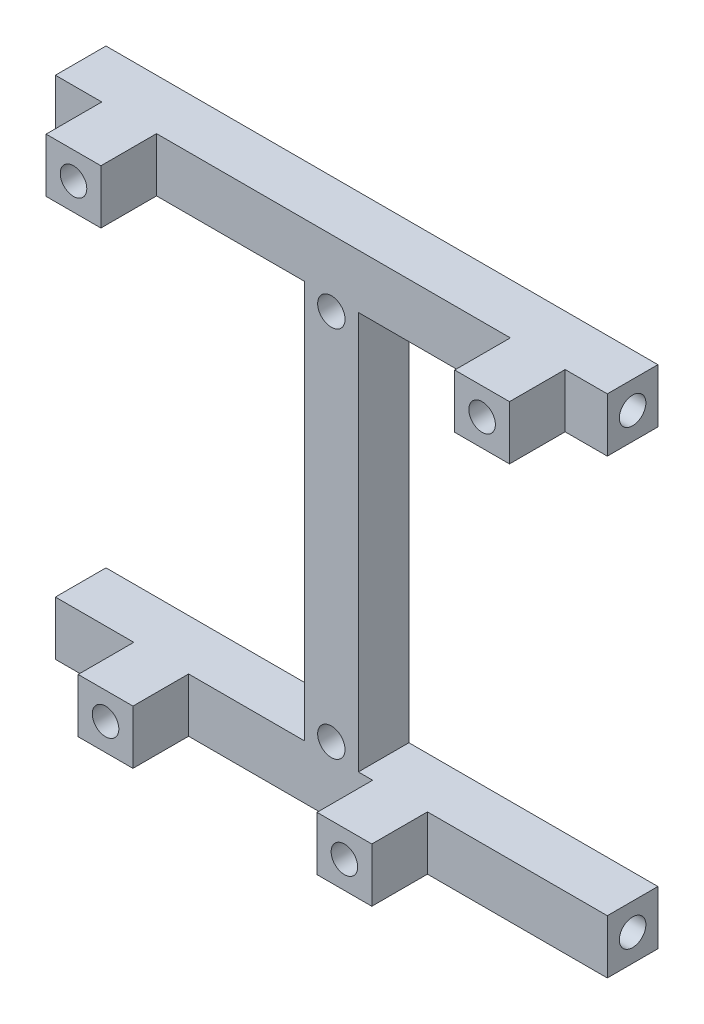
SolidWorks part; units mm, degrees
ref_plane "Front Plane" through (0, 0, 0) normal (0, 0, 1) x (1, 0, 0)
ref_plane "Top Plane" through (0, 0, 0) normal (0, 1, 0) x (1, 0, 0)
ref_plane "Right Plane" through (0, 0, 0) normal (1, 0, 0) x (0, 0, -1)
sketch "Sketch1" plane through (0, 0, 0) normal (0, 0, 1) x (1, 0, 0)
  line L1 (-39.73, -30) -> (39.73, -30)
  line L3 (-39.73, 30) -> (39.73, 30)
  line L5 (-39.73, -30) -> (39.73, 30) construction
  line L6 (-39.73, 30) -> (39.73, -30) construction
  line L8 (-39.73, 23.6) -> (-39.73, 30)
  line L9 (3.2, -23.6) -> (3.2, 23.6)
  line L10 (-3.2, -23.6) -> (-3.2, 23.6)
  line L11 (39.73, 23.6) -> (39.73, 30)
  line L12 (39.73, -23.6) -> (39.73, -30)
  line L13 (-39.73, -30) -> (-39.73, -23.6)
  line L14 (-39.73, -23.6) -> (-3.2, -23.6)
  line L15 (3.2, -23.6) -> (39.73, -23.6)
  line L16 (-39.73, 23.6) -> (-3.2, 23.6)
  line L17 (3.2, 23.6) -> (39.73, 23.6)
  point P0 (0, 0)
  dimension "D1" = 60
  dimension "D2" = 79.46
extrude "Boss-Extrude2" add sketch "Sketch1" along normal blind 6
sketch "Sketch2" plane through (0, 0, 6) normal (0, 0, 1) x (1, 0, 0)
  line L12 (21.23, 23.6) -> (27.73, 23.6)
  line L13 (27.73, 30) -> (21.23, 30)
  line L14 (27.73, 30) -> (27.73, 23.6)
  line L15 (-27.23, 30) -> (-20.73, 30)
  line L16 (21.23, 30) -> (21.23, 23.6)
  line L17 (-27.23, 23.6) -> (-27.23, 30)
  line L18 (-20.73, 23.6) -> (-20.73, 30)
  line L19 (-20.73, 23.6) -> (-27.23, 23.6)
  line L20 (-23.43, -30) -> (-16.93, -30)
  line L21 (-23.43, -30) -> (-23.43, -23.6)
  line L22 (-16.93, -30) -> (-16.93, -23.6)
  line L23 (-16.93, -23.6) -> (-23.43, -23.6)
  line L24 (4.9, -23.6) -> (11.4, -23.6)
  line L25 (11.4, -30) -> (11.4, -23.6)
  line L26 (4.9, -30) -> (4.9, -23.6)
  line L27 (11.4, -30) -> (4.9, -30)
extrude "Boss-Extrude3" add sketch "Sketch2" along normal blind 6.6
sketch "Sketch3" plane through (0, 0, 12.6) normal (0, 0, 1) x (1, 0, 0)
  line L0 (-23.43, -23.6) -> (-16.93, -30)
  line L1 (-16.93, -30) -> (-16.93, -23.6)
  line L2 (-16.93, -23.6) -> (-23.43, -30)
  line L3 (4.9, -23.6) -> (11.4, -30)
  line L4 (11.4, -30) -> (11.4, -23.6)
  line L5 (11.4, -23.6) -> (4.9, -30)
  line L6 (-27.23, 30) -> (-20.73, 23.6)
  line L7 (-20.73, 23.6) -> (-27.23, 23.6)
  line L8 (-27.23, 23.6) -> (-20.73, 30)
  line L9 (21.23, 23.6) -> (27.73, 30)
  line L10 (27.73, 30) -> (27.73, 23.6)
  line L11 (27.73, 23.6) -> (21.23, 30)
  circle A0 centre (-23.98, 26.8) radius 1.575
  circle A1 centre (24.48, 26.8) radius 1.575
  circle A2 centre (8.15, -26.8) radius 1.575
  circle A3 centre (-20.18, -26.8) radius 1.575
  dimension "D1" = 3.15
  dimension "D2" = 3.15
  dimension "D3" = 3.15
  dimension "D4" = 3.15
extrude "Cut-Extrude1" cut sketch "Sketch3" against normal blind 5 contours L2 A3 L0 | L2 A3 L0 | L0 A3 L2 | L0 A3 L2 | L5 A2 L3 | L3 A2 L5 | L5 A2 L3 | L3 A2 L5 | L8 A0 L6 | L6 A0 L8 | L8 A0 L6 | L6 A0 L8 | L9 A1 L11 | L11 A1 L9 | L9 A1 L11 | L11 A1 L9
sketch "Sketch4" plane through (0, 0, 6) normal (0, 0, 1) x (1, 0, 0)
  line L3 (-3.2, 0) -> (3.2, 0)
  line L4 (-3.2, 23.6) -> (-3.2, -23.6) construction
  line L5 (3.2, -23.6) -> (3.2, 23.6) construction
  line L6 (-3.2, -22.1) -> (3.2, -22.1)
  line L7 (-3.2, 22.1) -> (3.2, 22.1)
  circle A0 centre (0, 22.1) radius 1.625
  circle A1 centre (0, -22.1) radius 1.625
  dimension "D3" = 3.25
  dimension "D4" = 3.25
  dimension "D1" = 22.1
  dimension "D2" = 22.1
extrude "Cut-Extrude2" cut sketch "Sketch4" against normal through all contours L7 A0 | L7 A0 | L6 A1 | L6 A1
sketch "Sketch5" plane through (39.73, 0, 0) normal (1, 0, 0) x (0, 0, -1)
  line L0 (-6, 23.6) -> (0, 30)
  line L1 (-6, -30) -> (0, -23.6)
  circle A0 centre (-3, -26.8) radius 1.575
  circle A1 centre (-3, 26.8) radius 1.575
  dimension "D1" = 3.15
  dimension "D2" = 3.15
extrude "Cut-Extrude3" cut sketch "Sketch5" against normal blind 15 contours L1 A0 | L1 A0 | L0 A1 | L0 A1
sketch "Sketch6" plane through (-39.73, 0, 0) normal (-1, 0, 0) x (0, 0, 1)
  line L0 (0, 30) -> (6, 23.6)
  line L1 (0, -23.6) -> (6, -30)
  circle A0 centre (3, -26.8) radius 1.575
  circle A1 centre (3, 26.8) radius 1.575
  dimension "D1" = 3.15
  dimension "D2" = 3.15
extrude "Cut-Extrude4" cut sketch "Sketch6" against normal blind 15 contours L0 A1 | L0 A1 | L1 A0 | L1 A0
sketch "Sketch7" plane through (39.73, 0, 0) normal (1, 0, 0) x (0, 0, -1)
  line L1 (-6, -30) -> (0, -30)
  line L2 (-6, -30) -> (-6, 30)
  line L3 (-6, 30) -> (0, 30)
  line L4 (0, -30) -> (0, 30)
extrude "Cut-Extrude5" cut sketch "Sketch7" against normal blind 7
sketch "Sketch8" plane through (-39.73, 0, 0) normal (-1, 0, 0) x (0, 0, 1)
  line L1 (6, 30) -> (0, 30)
  line L2 (6, 30) -> (6, -30)
  line L3 (6, -30) -> (0, -30)
  line L4 (0, 30) -> (0, -30)
extrude "Cut-Extrude6" cut sketch "Sketch8" against normal blind 7
